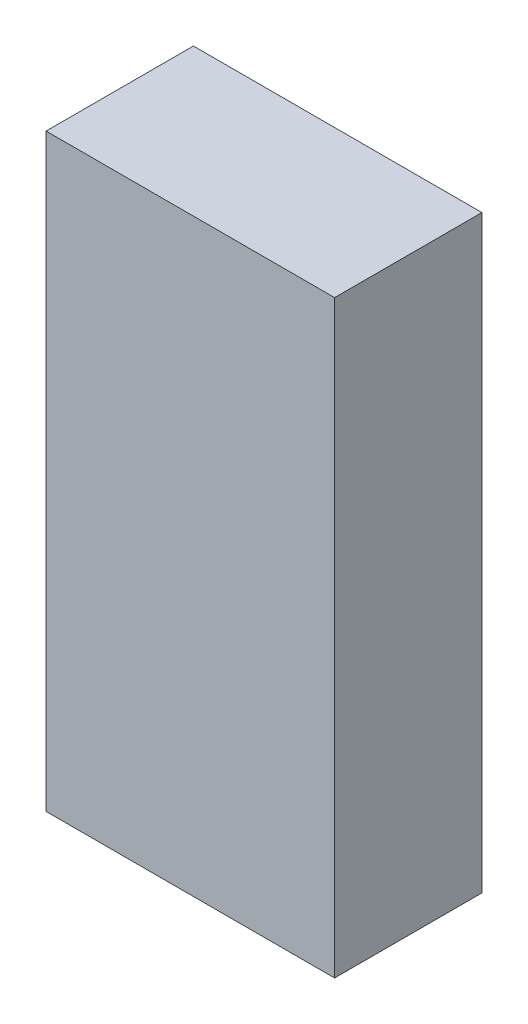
SolidWorks part; units mm, degrees
ref_plane "Front Plane" through (0, 0, 0) normal (0, 0, 1) x (1, 0, 0)
ref_plane "Top Plane" through (0, 0, 0) normal (0, 1, 0) x (1, 0, 0)
ref_plane "Right Plane" through (0, 0, 0) normal (1, 0, 0) x (0, 0, -1)
sketch "Sketch2" plane through (0, 0, 0) normal (0, 0, 1) x (1, 0, 0)
  line L1 (0, 0) -> (298.45, 0)
  line L2 (0, 0) -> (0, 609.6)
  line L3 (0, 609.6) -> (298.45, 609.6)
  line L4 (298.45, 0) -> (298.45, 609.6)
  dimension "D1" = 298.45
  dimension "D2" = 609.6
extrude "Boss-Extrude1" add sketch "Sketch2" along normal blind 152.4
